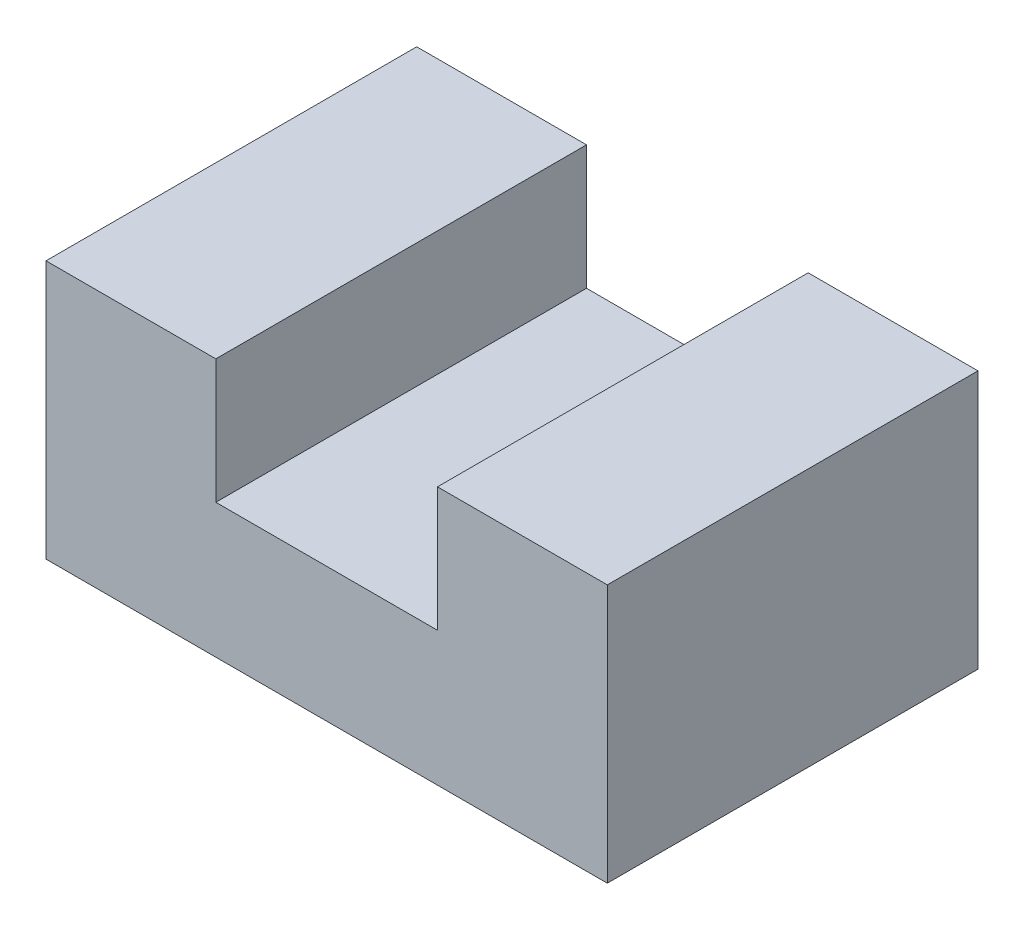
SolidWorks part; units mm, degrees
ref_plane "Front" through (0, 0, 0) normal (0, 0, 1) x (1, 0, 0)
ref_plane "Top" through (0, 0, 0) normal (0, 1, 0) x (1, 0, 0)
ref_plane "Right" through (0, 0, 0) normal (1, 0, 0) x (0, 0, -1)
sketch "Sketch1" plane through (0, 0, 0) normal (0, 0, 1) x (1, 0, 0)
  line L0 (0, 0) -> (0, 124.5757) construction
  line L1 (-83.2796, 0) -> (83.2796, 0)
  line L2 (83.2796, 0) -> (83.2796, 76.6708)
  line L3 (-83.2796, 0) -> (-83.2796, 76.6708)
  line L4 (83.2796, 76.6708) -> (32.8884, 76.6708)
  line L5 (-83.2796, 76.6708) -> (-32.8884, 76.6708)
  line L6 (32.8884, 76.6708) -> (32.8884, 39.8069)
  line L7 (-32.8884, 76.6708) -> (-32.8884, 39.8069)
  line L8 (32.8884, 39.8069) -> (-32.8884, 39.8069)
  point P12 (0, 39.8069)
extrude "Extrude1" add sketch "Sketch1" along normal mid plane 110
